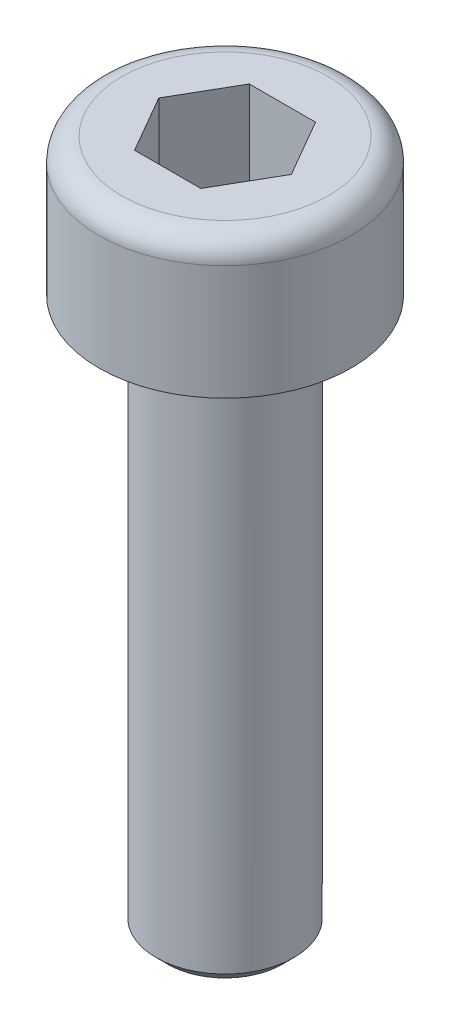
SolidWorks part; units mm, degrees
ref_plane "Plan1" through (0, 0, 0) normal (0, 0, 1) x (1, 0, 0)
ref_plane "Plan2" through (0, 0, 0) normal (0, 1, 0) x (1, 0, 0)
ref_plane "Plan3" through (0, 0, 0) normal (1, 0, 0) x (0, 0, -1)
sketch "Esquisse1" plane through (0, 0, 0) normal (0, 0, 1) x (1, 0, 0)
  line L0 (0, 16.088) -> (0, -1.0346) construction
  line L1 (0, 15) -> (-2.25, 15)
  line L3 (-2.75, 14.5) -> (-2.75, 12)
  line L4 (-2.75, 12) -> (-1.5, 12)
  line L7 (-1.5, 12) -> (-1.5, 0)
  line L12 (-1.5, 0) -> (0, 0)
  line L13 (0, 15) -> (0, 0)
  arc A0 (-2.75, 14.5) -> (-2.25, 15) centre (-2.25, 14.5) cw
  dimension "D1" = 0.5
  dimension "D2" = 5.5
  dimension "D3" = 12
  dimension "D4" = 3
  dimension "D5" = 3
revolve "Base-Révolution" add sketch "Esquisse1" angle 360 about L0
sketch "Esquisse2" plane through (0, 15, 0) normal (0, 1, 0) x (-1, 0, 0)
  line L0 (0.7217, -1.25) -> (-0.7217, 1.25) construction
  line L1 (1.4434, 0) -> (-1.4434, 0) construction
  line L2 (-0.7217, -1.25) -> (0.7217, 1.25) construction
  line L3 (1.4434, 0) -> (0.7217, -1.25)
  line L4 (0.7217, -1.25) -> (-0.7217, -1.25)
  line L5 (-0.7217, -1.25) -> (-1.4434, 0)
  line L6 (-1.4434, 0) -> (-0.7217, 1.25)
  line L7 (-0.7217, 1.25) -> (0.7217, 1.25)
  line L8 (0.7217, 1.25) -> (1.4434, 0)
  dimension "D1" = 2.5
extrude "Enlèv. mat.-Extru.1" cut sketch "Esquisse2" against normal blind 2
chamfer "Chanfrein1" distance 0.25 angle 45
